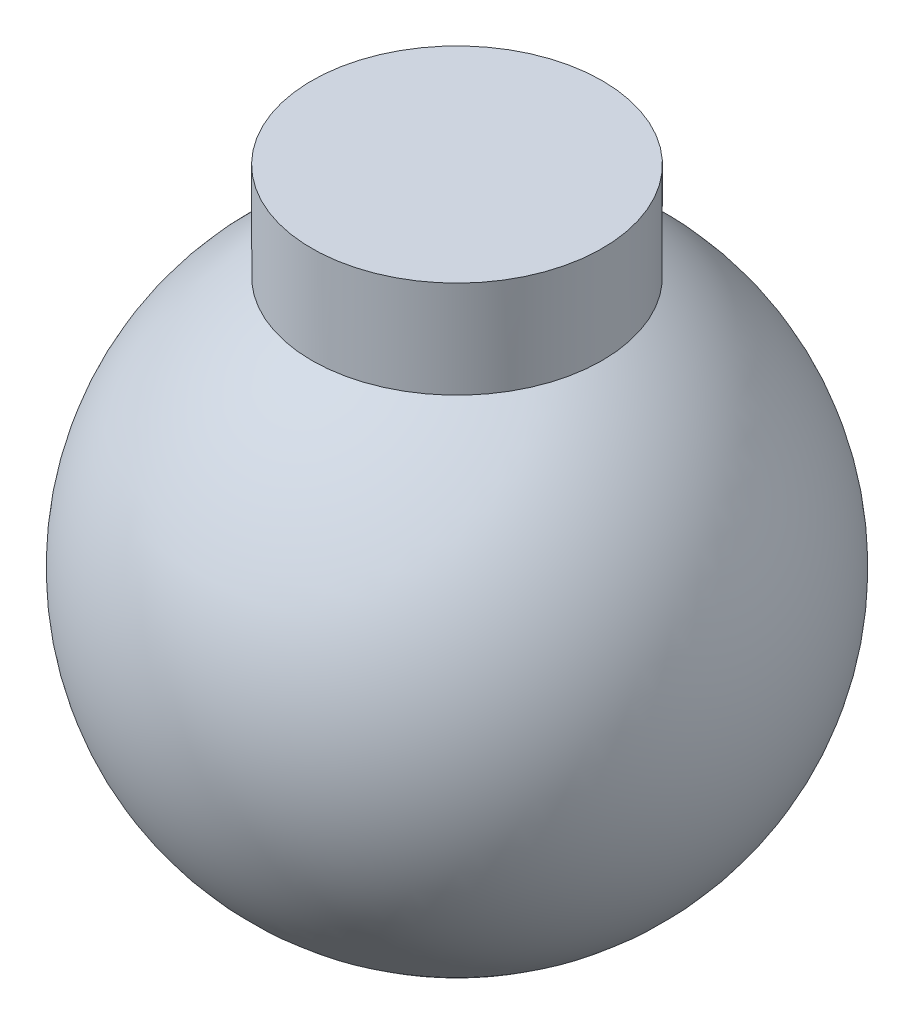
SolidWorks part; units mm, degrees
ref_plane "Front Plane" through (0, 0, 0) normal (0, 0, 1) x (1, 0, 0)
ref_plane "Top Plane" through (0, 0, 0) normal (0, 1, 0) x (1, 0, 0)
ref_plane "Right Plane" through (0, 0, 0) normal (1, 0, 0) x (0, 0, -1)
sketch "Sketch1" plane through (0, 0, 0) normal (0, 0, 1) x (1, 0, 0)
  line L0 (0, 0) -> (0, 5) construction
  line L3 (2.5, 4.3301) -> (2.5, 6)
  line L4 (0, 6) -> (2.5, 6)
  line L5 (0, 6) -> (0, -5)
  arc A0 (0, -5) -> (2.5, 4.3301) centre (0, 0) ccw
  dimension "D1" = 10
  dimension "D2" = 6
  dimension "D3" = 2.5
revolve "Revolve1" add sketch "Sketch1" angle 360 about L0
